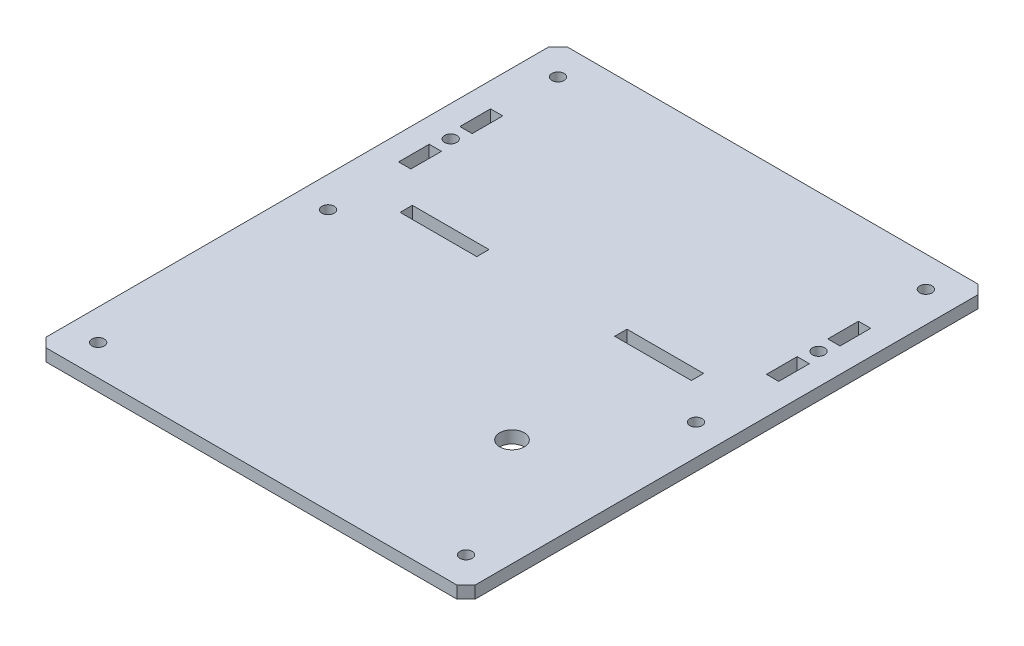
SolidWorks part; units mm, degrees
ref_plane "Front Plane" through (0, 0, 0) normal (0, 0, 1) x (1, 0, 0)
ref_plane "Top Plane" through (0, 0, 0) normal (0, 1, 0) x (1, 0, 0)
ref_plane "Right Plane" through (0, 0, 0) normal (1, 0, 0) x (0, 0, -1)
sketch "Sketch2" plane through (0, 0, 0) normal (0, 1, 0) x (1, 0, 0)
  line L0 (-70, 82) -> (-67, 85)
  line L1 (-67, -85) -> (67, -85)
  line L2 (-70, -82) -> (-70, 82)
  line L3 (-67, 85) -> (67, 85)
  line L4 (70, -82) -> (70, 82)
  line L5 (-70, -85) -> (70, 85) construction
  line L6 (-70, 85) -> (70, -85) construction
  line L7 (67, 85) -> (70, 82)
  line L8 (67, -85) -> (70, -82)
  line L9 (-70, -82) -> (-67, -85)
  point P0 (0, 0)
  dimension "D1" = 140
  dimension "D2" = 170
extrude "Boss-Extrude1" add sketch "Sketch2" against normal blind 4
sketch "Sketch3" plane through (0, 0, 0) normal (0, 1, 0) x (1, 0, 0)
  line L0 (0, 85) -> (0, -85) construction
  line L1 (-47.5, 15) -> (-22.5, 15)
  line L2 (-47.5, 15) -> (-47.5, 11)
  line L3 (-47.5, 11) -> (-22.5, 11)
  line L4 (-22.5, 15) -> (-22.5, 11)
  line L5 (-47.5, 15) -> (-22.5, 11) construction
  line L6 (-47.5, 11) -> (-22.5, 15) construction
  line L7 (67, 85) -> (-67, 85) construction
  line L8 (-67, -85) -> (67, -85) construction
  line L9 (-70, 82) -> (-70, -82) construction
  line L10 (-62, 35) -> (-58, 35)
  line L11 (-62, 35) -> (-62, 25)
  line L12 (-62, 25) -> (-58, 25)
  line L13 (-58, 35) -> (-58, 25)
  line L14 (-62, 35) -> (-58, 25) construction
  line L15 (-62, 25) -> (-58, 35) construction
  line L16 (-60, 75) -> (-60, 0) construction
  line L17 (-62, 55) -> (-58, 55)
  line L18 (-62, 55) -> (-62, 45)
  line L19 (-62, 45) -> (-58, 45)
  line L20 (-58, 55) -> (-58, 45)
  line L21 (-62, 55) -> (-58, 45) construction
  line L22 (-62, 45) -> (-58, 55) construction
  line L23 (62, 45) -> (58, 55) construction
  line L24 (62, 55) -> (58, 45) construction
  line L25 (60, 75) -> (60, 0) construction
  line L26 (62, 25) -> (58, 35) construction
  line L27 (62, 35) -> (58, 25) construction
  line L28 (47.5, 11) -> (22.5, 15) construction
  line L29 (47.5, 15) -> (22.5, 11) construction
  line L30 (58, 55) -> (58, 45)
  line L31 (62, 45) -> (58, 45)
  line L32 (62, 55) -> (62, 45)
  line L33 (62, 55) -> (58, 55)
  line L34 (58, 35) -> (58, 25)
  line L35 (62, 25) -> (58, 25)
  line L36 (62, 35) -> (62, 25)
  line L37 (62, 35) -> (58, 35)
  line L38 (22.5, 15) -> (22.5, 11)
  line L39 (47.5, 11) -> (22.5, 11)
  line L40 (47.5, 15) -> (47.5, 11)
  line L41 (47.5, 15) -> (22.5, 15)
  circle A0 centre (35, -35) radius 4
  circle A1 centre (-60, 75) radius 2
  circle A2 centre (-60, 0) radius 2
  circle A3 centre (-60, -75) radius 2
  circle A4 centre (-60, 40) radius 2
  circle A5 centre (60, 40) radius 2
  circle A6 centre (60, -75) radius 2
  circle A7 centre (60, 0) radius 2
  circle A8 centre (60, 75) radius 2
  point P0 (-35, 13)
  point P11 (-60, 30)
  point P22 (-60, 35)
  point P23 (-60, 25)
  point P32 (-60, 50)
  point P57 (60, 50)
  point P58 (60, 30)
  point P59 (35, 13)
  dimension "D1" = 4
  dimension "D4" = 8
  dimension "D14" = 4
  dimension "D2" = 10
  dimension "D3" = 10
  dimension "D5" = 72
  dimension "D6" = 25
  dimension "5" = 35
  dimension "D7" = 4
  dimension "D9" = 75
  dimension "D10" = 10
  dimension "D11" = 4
  dimension "D12" = 10
  dimension "D15" = 10
  dimension "D16" = 50
  dimension "D8" = 3
  dimension "D13" = 2
extrude "Cut-Extrude1" cut sketch "Sketch3" against normal through all both and the other way through all
sketch "Sketch4" plane through (0, 0, 0) normal (0, 1, 0) x (1, 0, 0)
  line L0 (67, 85) -> (-67, 85) construction
  point P0 (0, 0)
  point P3 (0, 85)
  dimension "D1" = 6
sketch_block_instance "Block-Part3-1"
sketch_block "Block-Part3" parameters "D1"=50, "D2"=4, "D3"=10, "D4"=4, "D5"=10, "D6"=20, "D7"=20, "D8"=8.5, "D9"=3.1, "D10"=4, "D11"=6.8, "D12"=4, "D13"=8.5, "D14"=4, "D15"=3.1, "D16"=4, "D17"=6.8, "D18"=50, "D19"=4.5006, "D20"=3.598
sketch_block_instance "Block-Part3-2"
